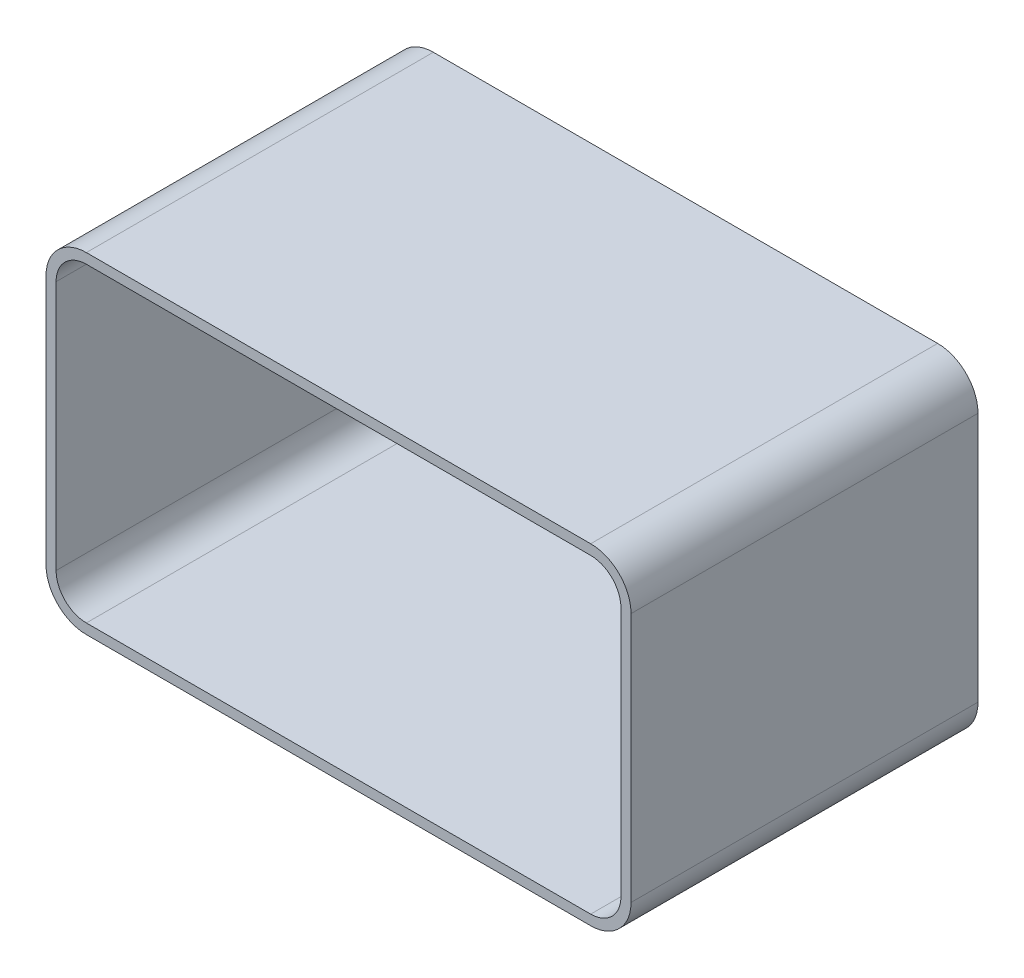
SolidWorks part; units mm, degrees
ref_plane "Plane1" through (0, 0, 0) normal (0, 0, 1) x (1, 0, 0)
ref_plane "Plane2" through (0, 0, 0) normal (0, 1, 0) x (1, 0, 0)
ref_plane "Plane3" through (0, 0, 0) normal (1, 0, 0) x (0, 0, -1)
sketch "Sketch1" plane through (0, 0, 0) normal (0, 0, 1) x (1, 0, 0)
  line L1 (0, 0) -> (290, 0)
  line L2 (0, 0) -> (0, 164)
  line L3 (0, 164) -> (290, 164)
  line L4 (290, 0) -> (290, 164)
  dimension "box_width" = 290
  dimension "box_height" = 164
extrude "Box" add sketch "Sketch1" against normal blind 172
fillet "OutsideCorners" radius 20 4 edges at (0, 164, -86) (290, 164, -86) (290, 0, -86) (0, 0, -86)
shell "Shell1" thickness 5
